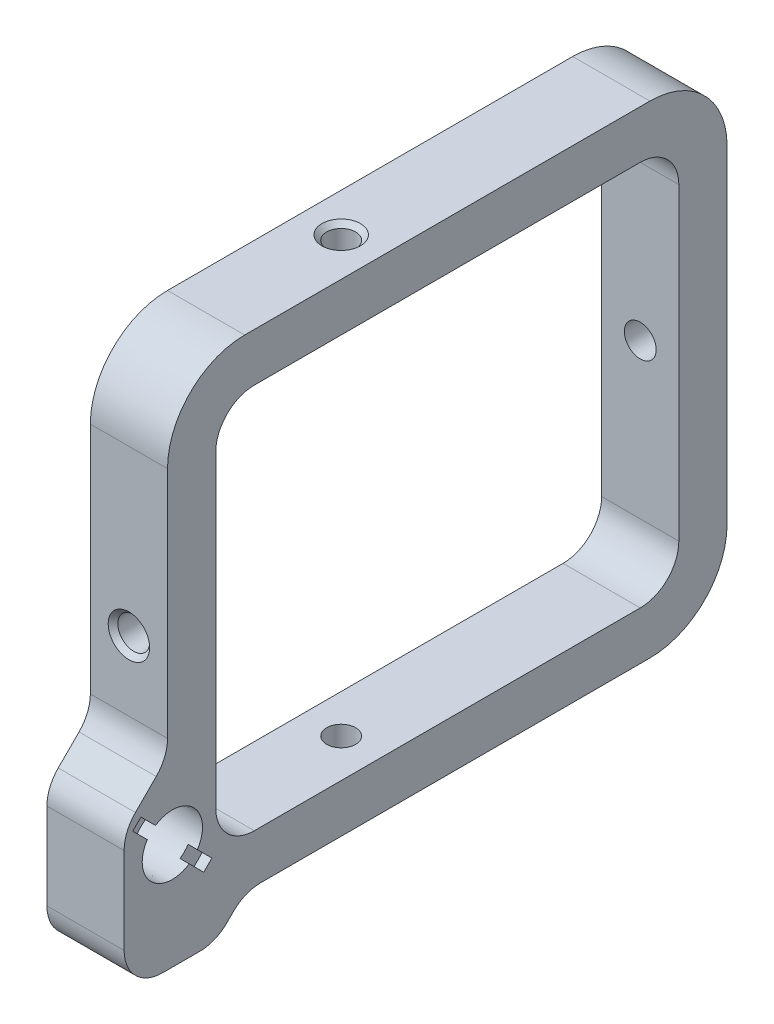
SolidWorks part; units mm, degrees
ref_plane "Front Plane" through (0, 0, 0) normal (1, 0, 0) x (0, 1, 0)
ref_plane "Top Plane" through (0, 0, 0) normal (0, 0, 1) x (0, 1, 0)
ref_plane "Right Plane" through (0, 0, 0) normal (0, 1, 0) x (-1, 0, 0)
sketch "Sketch1" plane through (0, 0, 0) normal (1, 0, 0) x (0, 1, 0)
  line L0 (-25, 0) -> (25, 0)
  line L1 (25, 0) -> (25, 58)
  line L2 (25, 58) -> (-8.875, 58)
  line L4 (-20, 5) -> (20, 5)
  line L5 (20, 5) -> (20, 53)
  line L6 (20, 53) -> (-20, 53)
  line L7 (-20, 53) -> (-20, 5)
  line L8 (0, 53) -> (0, 56) construction
  line L9 (-8.875, 58) -> (-13.375, 62.5)
  line L10 (-13.375, 62.5) -> (-28, 62.5)
  line L12 (-28, 53) -> (-25, 50)
  line L13 (-23.5, 57.5) -> (-23.5, 62.5) construction
  line L14 (-23.5, 57.5) -> (-28, 57.5) construction
  line L15 (-28, 62.5) -> (-28, 53)
  line L16 (-25, 50) -> (-25, 0)
  line L17 (-13.875, 57.5) -> (-13.875, 62.5) construction
  line L18 (-20, 5) -> (-25, 5) construction
  line L19 (-20, 5) -> (-20, 0) construction
  line L20 (20, 53) -> (20, 58) construction
  circle A1 centre (-17, 57.5) radius 3.125
  point P4 (0, 0)
  point P10 (0, 5)
  dimension "D7" = 6.25
  dimension "D1" = 40
  dimension "D2" = 135
  dimension "D3" = 4.5
  dimension "D4" = 48
  dimension "D8" = 17
  dimension "D9" = 23.5
  dimension "D10" = 5
  dimension "D11" = 4.5
  dimension "D12" = 5
  dimension "D13" = 0.5
extrude "Boss-Extrude1" add sketch "Sketch1" along normal blind 8
sketch "Sketch6" plane through (0, -25, 0) normal (0, -1, 0) x (1, 0, 0)
  line L0 (8, 50) -> (0, 50) construction
  circle A0 centre (4, 36) radius 1.5
  point P4 (4, 50)
  dimension "D2" = 3
  dimension "D1" = 17
extrude "Cut-Extrude2" cut sketch "Sketch6" against normal through all
sketch "Sketch5" plane through (0, 0, 0) normal (0, 0, -1) x (1, 0, 0)
  line L1 (8, 25) -> (0, 25) construction
  circle A0 centre (4, 0) radius 1.65
  point P5 (4, 25)
  dimension "D1" = 3.3
extrude "Cut-Extrude4" cut sketch "Sketch5" against normal through all
chamfer "Chamfer1" distance 0.5 angle 45 4 edges at (4, 25, 34.5) (4, -25, 34.5) (2.35, 0, 0) (4, 1.65, 58)
sketch "Sketch8" plane through (8, 0, 0) normal (1, 0, 0) x (0, 1, 0)
  line L0 (-20.677, 53.823) -> (-13.323, 61.177) construction
  line L1 (20, 53) -> (-20, 53) construction
  line L2 (-13.7473, 61.6012) -> (-12.8988, 60.7527)
  line L3 (-12.8988, 60.7527) -> (-20.2527, 53.3988)
  line L4 (-20.2527, 53.3988) -> (-21.1012, 54.2473)
  line L5 (-21.1012, 54.2473) -> (-13.7473, 61.6012)
  circle A0 centre (-17, 57.5) radius 3.125 construction
  point P4 (-17, 57.5)
  point P10 (-13.323, 61.177)
  dimension "D1" = 10.4
  dimension "D2" = 45
  dimension "D3" = 1.2
extrude "Cut-Extrude3" cut sketch "Sketch8" against normal blind 1
fillet "Fillet1" radius 4 5 edges at (4, -28, 53) (4, -25, 50) (4, -28, 62.5) (4, -13.375, 62.5) (4, -8.875, 58)
fillet "Fillet2" radius 8 3 edges at (4, -25, 0) (4, 25, 0) (4, 25, 58)
fillet "Fillet3" radius 4 4 edges at (4, -20, 53) (4, -20, 5) (4, 20, 5) (4, 20, 53)
chamfer "Chamfer2" distance 8 distance2 0.5 1 edges at (0, -17, 54.375)
